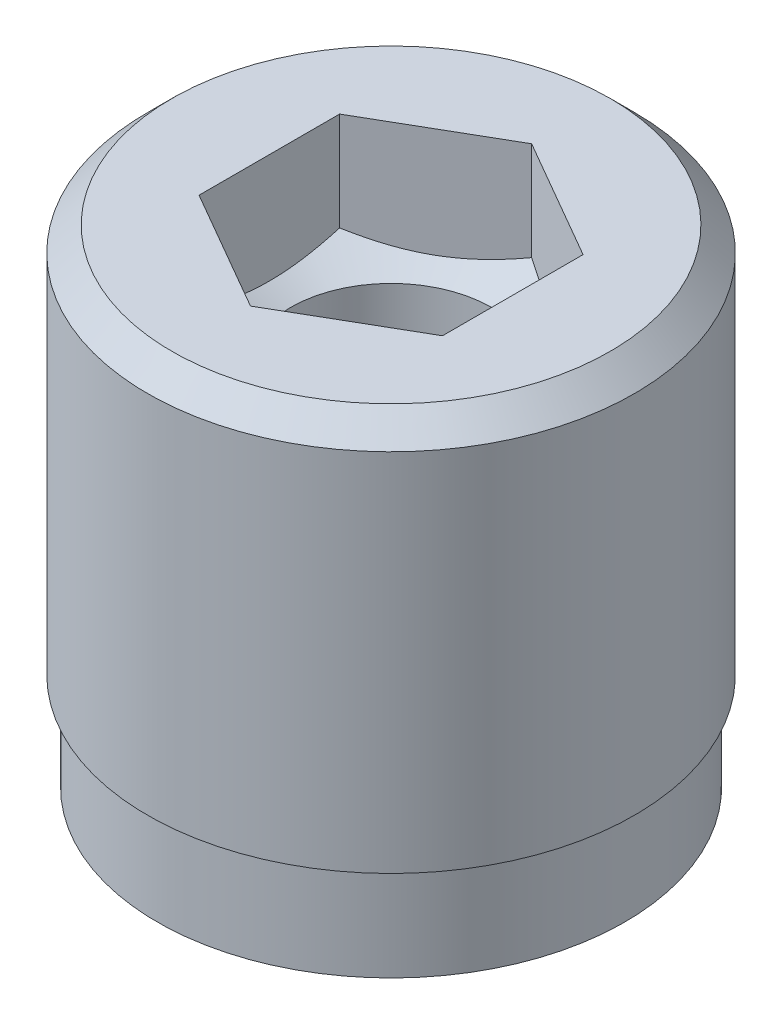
SolidWorks part; units mm, degrees
ref_plane "Vorne" through (0, 0, 0) normal (0, 0, 1) x (1, 0, 0)
ref_plane "Oben" through (0, 0, 0) normal (0, 1, 0) x (1, 0, 0)
ref_plane "Rechts" through (0, 0, 0) normal (1, 0, 0) x (0, 0, -1)
sketch "Skizze1" plane through (0, 0, 0) normal (0, 0, 1) x (1, 0, 0)
  line L0 (0, 0) -> (0, 7.1062) construction
  line L1 (2.065, -3.75) -> (4.8, -3.75)
  line L2 (2.065, -3.75) -> (2.065, 3.75)
  line L3 (2.265, 6.25) -> (4.5, 6.25)
  line L4 (5, -1.75) -> (5, 5.75)
  line L5 (2.065, 3.75) -> (2.265, 3.8655)
  line L6 (2.265, 3.8655) -> (2.265, 6.25)
  line L7 (4.5, 6.25) -> (5, 5.75)
  line L8 (5, -1.75) -> (4.8, -1.75)
  line L9 (4.8, -3.75) -> (4.8, -1.75)
  point P1 (5, 6.25)
  point P7 (2.065, 0)
  dimension "D1" = 10
  dimension "D2" = 4.13
  dimension "D3" = 10
  dimension "D4" = 0.2
  dimension "D5" = 2
  dimension "D6" = 0.2
  dimension "D7" = 2.5
  dimension "D8" = 60
  dimension "D11" = 0.5
revolve "Rotation1" add sketch "Skizze1" angle 360 about L0
sketch "Skizze2" plane through (0, 6.25, 0) normal (0, 1, 0) x (1, 0, 0)
  line L1 (0, 2.8868) -> (-2.5, 1.4434)
  line L2 (-2.5, 1.4434) -> (-2.5, -1.4434)
  line L3 (-2.5, -1.4434) -> (0, -2.8868)
  line L4 (0, -2.8868) -> (2.5, -1.4434)
  line L5 (2.5, -1.4434) -> (2.5, 1.4434)
  line L6 (2.5, 1.4434) -> (0, 2.8868)
  circle A0 centre (0, 0) radius 2.5 construction
  dimension "D1" = 5
extrude "Linear austragen1" cut sketch "Skizze2" against normal up to surface (2.0256 mm away)
sketch "Skizze3" [suppressed] plane through (0, 0, 0) normal (0, 0, 1) x (1, 0, 0)
  line L0 (5.5, 8.75) -> (6.5, 8.75)
  line L1 (6.5, 8.75) -> (5.5, 7.75)
  line L2 (5.5, 7.75) -> (5.5, 8.75)
  line L3 (0, 0) -> (0, 7.7087) construction
  dimension "D1" = 45
revolve "Rotation2" [suppressed] add sketch "Skizze3" angle 360 about L3
equation "\"D4@Skizze1\" = \"D3@Skizze1\" / 50"
equation "\"D5@Skizze1\" = \"D1@Skizze1\" / 5"
